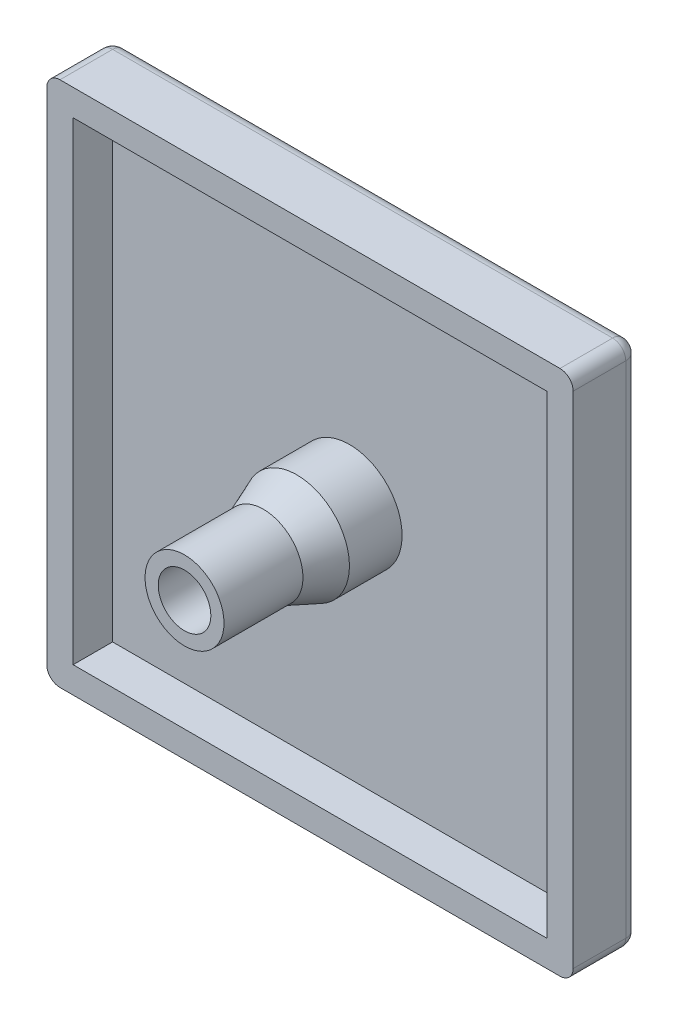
SolidWorks part; units mm, degrees
ref_plane "前视基准面" through (0, 0, 0) normal (0, 0, 1) x (1, 0, 0)
ref_plane "上视基准面" through (0, 0, 0) normal (0, 1, 0) x (1, 0, 0)
ref_plane "右视基准面" through (0, 0, 0) normal (1, 0, 0) x (0, 0, -1)
sketch "草图1" plane through (0, 0, 0) normal (0, 0, 1) x (1, 0, 0)
  line L1 (-10, 10) -> (10, 10)
  line L2 (-10, 10) -> (-10, -10)
  line L3 (-10, -10) -> (10, -10)
  line L4 (10, 10) -> (10, -10)
  dimension "D1" = 20
  dimension "D2" = 20
  dimension "D3" = 10
extrude "凸台-拉伸1" add sketch "草图1" along normal mid plane 2.5
fillet "圆角1" radius 0.5 8 edges at (0, 10, -1.25) (-10, 10, 0) (-10, 0, -1.25) (-10, -10, 0) (10, -10, 0) (0, -10, -1.25) (10, 0, -1.25) (10, 10, 0)
shell "抽壳1" thickness 1
sketch "草图2" plane through (0, 0, 0) normal (0, 1, 0) x (1, 0, 0)
  line L0 (0, 0.25) -> (2, 0.25)
  line L1 (-9, 0.25) -> (9, 0.25) construction
  line L2 (2, 0.25) -> (2, -1.75)
  line L3 (2, -1.75) -> (1.5, -3.0167)
  line L4 (1.5, -3.0167) -> (1.5, -6.0167)
  line L5 (1.5, -6.0167) -> (0, -6.0167)
  line L6 (0, -6.0167) -> (0, 0)
  line L7 (0, 0) -> (0, 0.25)
  dimension "D1" = 1.5
  dimension "D2" = 2
  dimension "D3" = 3
revolve "旋转2" add sketch "草图2" angle 360 about L6
shell "抽壳2" thickness 0.5
